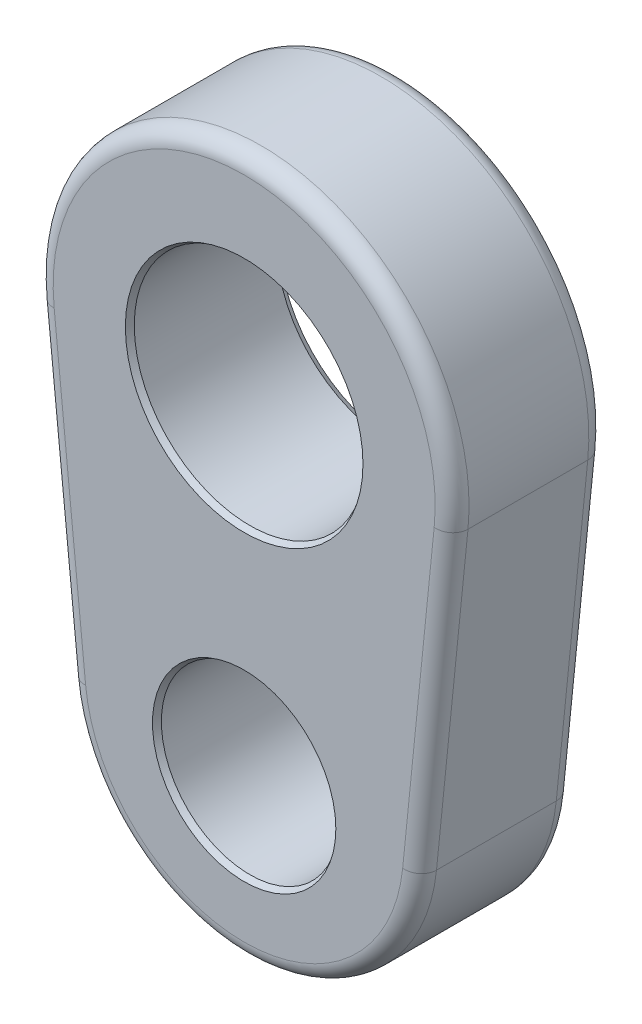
SolidWorks part; units mm, degrees
ref_plane "Frontale" through (0, 0, 0) normal (0, 0, 1) x (1, 0, 0)
ref_plane "Superiore" through (0, 0, 0) normal (0, 1, 0) x (1, 0, 0)
ref_plane "Destro" through (0, 0, 0) normal (1, 0, 0) x (0, 0, -1)
sketch "Sketch1" plane through (0, 0, 0) normal (0, 0, 1) x (1, 0, 0)
  line L0 (3.9423, -7.4603) -> (4.6498, -0.4707)
  line L1 (-3.9423, -7.4603) -> (-4.6498, -0.4707)
  circle A0 centre (0, 0) radius 2.5972
  arc A2 (4.6498, -0.4707) -> (-4.6498, -0.4707) centre (0, 0) ccw
  arc A3 (-3.9423, -7.4603) -> (3.9423, -7.4603) centre (0, -7.0612) ccw
  circle A4 centre (0, -7.4056) radius 1.9875
  dimension "D1" = 3.9751
  dimension "D2" = 5.1943
  dimension "D3" = 7.0612
  dimension "D4" = 4.6736
  dimension "D5" = 3.9624
  dimension "D6" = 7.4056
extrude "Extrude1" add sketch "Sketch1" along normal mid plane 3.4544
chamfer "Chamfer1" distance 0.127 angle 30 2 edges at (2.5972, 0, 1.7272) (1.9875, -7.4056, 1.7272)
chamfer "Chamfer2" distance 0.127 angle 30 2 edges at (2.5972, 0, -1.7272) (1.9875, -7.4056, -1.7272)
fillet "Fillet1" radius 0.381 8 edges at (4.296, -3.9655, -1.7272) (0, -11.0236, -1.7272) (-4.296, -3.9655, -1.7272) (4.296, -3.9655, 1.7272) (0, -11.0236, 1.7272) (-4.296, -3.9655, 1.7272) (0, 4.6736, -1.7272) (0, 4.6736, 1.7272)
